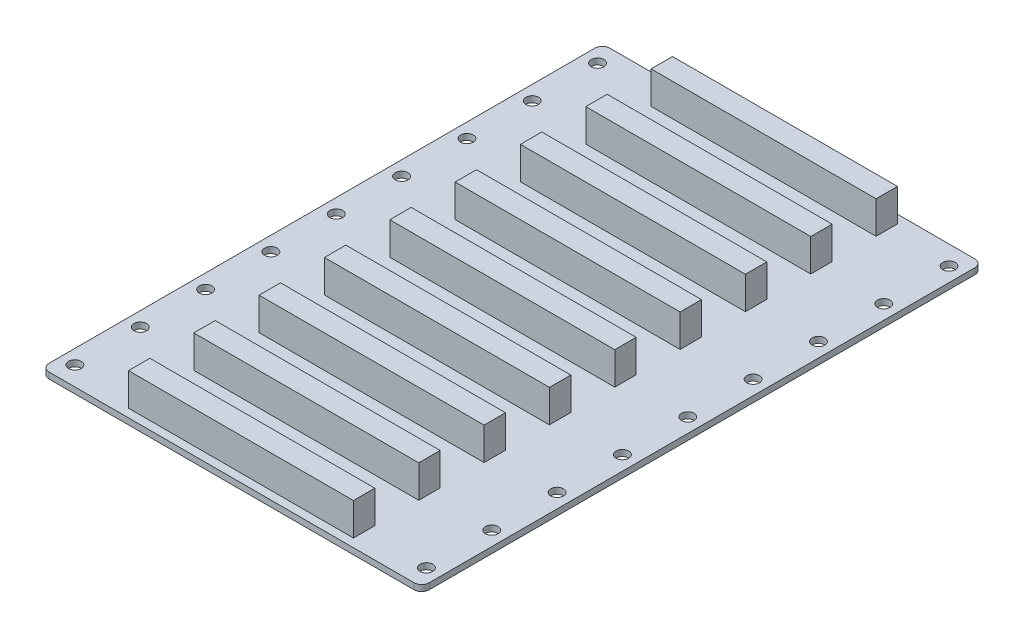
SolidWorks part; units mm, degrees
ref_plane "Front Plane" through (0, 0, 0) normal (0, 0, 1) x (1, 0, 0)
ref_plane "Top Plane" through (0, 0, 0) normal (0, 1, 0) x (1, 0, 0)
ref_plane "Right Plane" through (0, 0, 0) normal (1, 0, 0) x (0, 0, -1)
sketch "Sketch1" plane through (0, 0, 0) normal (0, 1, 0) x (1, 0, 0)
  line L1 (-49.75, -73.4) -> (49.75, -73.4)
  line L2 (-49.75, -73.4) -> (-49.75, 73.4)
  line L3 (-49.75, 73.4) -> (49.75, 73.4)
  line L4 (49.75, -73.4) -> (49.75, 73.4)
  line L5 (-49.75, -73.4) -> (49.75, 73.4) construction
  line L6 (-49.75, 73.4) -> (49.75, -73.4) construction
  point P0 (0, 0)
  dimension "D1" = 99.5
  dimension "D2" = 146.8
extrude "Boss-Extrude1" add sketch "Sketch1" along normal blind 1.6
sketch "Sketch3" plane through (0, 1.6, 0) normal (0, 1, 0) x (1, 0, 0)
  line L0 (0, 73.4) -> (0, -73.4) construction
  line L1 (49.75, 73.4) -> (-49.75, 73.4) construction
  line L2 (-49.75, -73.4) -> (49.75, -73.4) construction
  line L4 (-49.75, 73.4) -> (-49.75, -73.4) construction
  circle A1 centre (-46, -68.4) radius 1.65
  circle A3 centre (-46, -51.3) radius 1.65
  circle A4 centre (-46, -34.2) radius 1.65
  circle A5 centre (-46, -17.1) radius 1.65
  circle A6 centre (-46, 0) radius 1.65
  circle A7 centre (-46, 17.1) radius 1.65
  circle A8 centre (-46, 34.2) radius 1.65
  circle A9 centre (-46, 51.3) radius 1.65
  circle A10 centre (-46, 68.4) radius 1.65
  circle A11 centre (46, 68.4) radius 1.65
  circle A12 centre (46, 51.3) radius 1.65
  circle A13 centre (46, 34.2) radius 1.65
  circle A14 centre (46, 17.1) radius 1.65
  circle A15 centre (46, 0) radius 1.65
  circle A16 centre (46, -17.1) radius 1.65
  circle A17 centre (46, -34.2) radius 1.65
  circle A18 centre (46, -51.3) radius 1.65
  circle A19 centre (46, -68.4) radius 1.65
  dimension "D1" = 3.3
  dimension "D2" = 3.75
  dimension "D3" = 9
  dimension "D4" = 17.1
  dimension "D5" = 5
extrude "Cut-Extrude2" cut sketch "Sketch3" against normal up to surface (1.6 mm away)
sketch "Sketch4" plane through (0, 1.6, 0) normal (0, 1, 0) x (1, 0, 0)
  line L0 (-29.195, -54.1) -> (-29.195, -48.5)
  line L1 (-29.195, -71.2) -> (29.695, -71.2)
  line L2 (-29.195, -71.2) -> (-29.195, -65.6)
  line L3 (-29.195, -65.6) -> (29.695, -65.6)
  line L4 (29.695, -71.2) -> (29.695, -65.6)
  line L5 (-29.195, -71.2) -> (29.695, -65.6) construction
  line L6 (-29.195, -65.6) -> (29.695, -71.2) construction
  line L7 (-49.75, -73.4) -> (49.75, -73.4) construction
  line L8 (49.75, -73.4) -> (49.75, 73.4) construction
  line L9 (-29.195, -54.1) -> (29.695, -54.1)
  line L10 (29.695, -54.1) -> (29.695, -48.5)
  line L11 (-29.195, -48.5) -> (29.695, -48.5)
  line L12 (-29.195, -37) -> (-29.195, -31.4)
  line L13 (-29.195, -37) -> (29.695, -37)
  line L14 (29.695, -37) -> (29.695, -31.4)
  line L15 (-29.195, -31.4) -> (29.695, -31.4)
  line L16 (-29.195, -19.9) -> (-29.195, -14.3)
  line L17 (-29.195, -19.9) -> (29.695, -19.9)
  line L18 (29.695, -19.9) -> (29.695, -14.3)
  line L19 (-29.195, -14.3) -> (29.695, -14.3)
  line L20 (-29.195, -2.8) -> (-29.195, 2.8)
  line L21 (-29.195, -2.8) -> (29.695, -2.8)
  line L22 (29.695, -2.8) -> (29.695, 2.8)
  line L23 (-29.195, 2.8) -> (29.695, 2.8)
  line L24 (-29.195, 14.3) -> (-29.195, 19.9)
  line L25 (-29.195, 14.3) -> (29.695, 14.3)
  line L26 (29.695, 14.3) -> (29.695, 19.9)
  line L27 (-29.195, 19.9) -> (29.695, 19.9)
  line L28 (-29.195, 31.4) -> (-29.195, 37)
  line L29 (-29.195, 31.4) -> (29.695, 31.4)
  line L30 (29.695, 31.4) -> (29.695, 37)
  line L31 (-29.195, 37) -> (29.695, 37)
  line L32 (-29.195, 48.5) -> (-29.195, 54.1)
  line L33 (-29.195, 48.5) -> (29.695, 48.5)
  line L34 (29.695, 48.5) -> (29.695, 54.1)
  line L35 (-29.195, 54.1) -> (29.695, 54.1)
  line L36 (-29.195, 65.6) -> (-29.195, 71.2)
  line L37 (-29.195, 65.6) -> (29.695, 65.6)
  line L38 (29.695, 65.6) -> (29.695, 71.2)
  line L39 (-29.195, 71.2) -> (29.695, 71.2)
  point P0 (0.25, -68.4)
  dimension "D1" = 5.6
  dimension "D2" = 58.89
  dimension "D3" = 5
  dimension "D4" = 49.5
  dimension "D6" = 11.5
  dimension "D5" = 9
extrude "Boss-Extrude2" add sketch "Sketch4" along normal blind 8.5
fillet "Fillet2" radius 2 4 edges at (-49.75, 0.8, -73.4) (49.75, 0.8, -73.4) (49.75, 0.8, 73.4) (-49.75, 0.8, 73.4)
